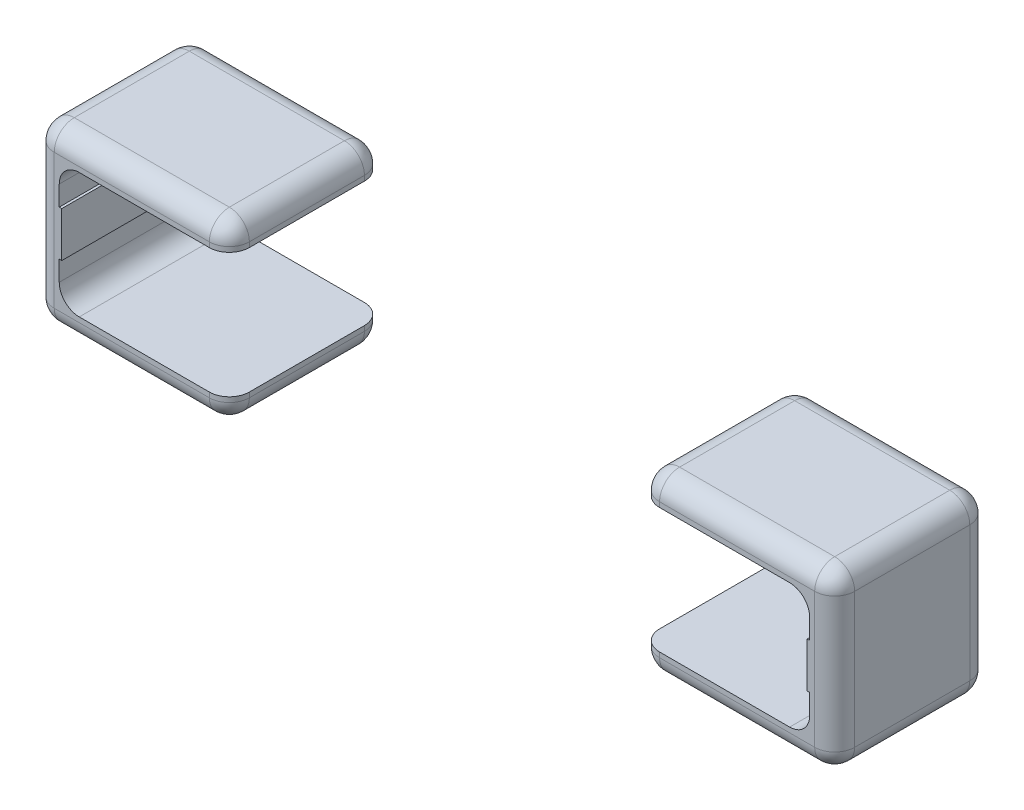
SolidWorks part; units mm, degrees
ref_plane "Front Plane" through (0, 0, 0) normal (0, 0, 1) x (1, 0, 0)
ref_plane "Top Plane" through (0, 0, 0) normal (0, 1, 0) x (1, 0, 0)
ref_plane "Right Plane" through (0, 0, 0) normal (1, 0, 0) x (0, 0, -1)
sketch "Skizze1" plane through (0, 0, 0) normal (0, 0, 1) x (1, 0, 0)
  line L2 (-40, 12.5) -> (-40, -5)
  line L3 (-40, -5) -> (40, -5)
  line L5 (-40, -3) -> (-40, 10.5) construction
  line L6 (-22, -5) -> (-38, -5) construction
  line L7 (-40, 12.5) -> (40, 12.5)
  line L9 (40, -5) -> (40, 12.5)
  line L10 (22, 12.5) -> (38, 12.5) construction
  line L11 (40, 10.5) -> (40, -3) construction
extrude "Linear austragen1" add sketch "Skizze1" against normal blind 15 and the other way blind 1.5
sketch "Skizze2" plane through (0, 0, 1.5) normal (0, 0, 1) x (1, 0, 0)
  line L0 (40, -5) -> (40, 12.5) construction
  line L1 (-50, 22.5) -> (50, 22.5)
  line L2 (-50, 22.5) -> (-50, -15)
  line L3 (-50, -15) -> (50, -15)
  line L4 (50, 22.5) -> (50, -15)
  line L5 (-40, 12.5) -> (-40, -5) construction
  line L6 (-40, -5) -> (40, -5) construction
  line L7 (40, 12.5) -> (-40, 12.5) construction
  dimension "D1" = 10
  dimension "D2" = 10
  dimension "D3" = 10
  dimension "D4" = 10
extrude "Schnitt-Linear austragen1" cut sketch "Skizze2" against normal blind 1
sketch "Skizze4" plane through (0, 0, 0.5) normal (0, 0, 1) x (1, 0, 0)
  line L0 (-37.5, 6) -> (-37.5, 8) construction
  line L5 (-37.5, 6) -> (-37.5, 8)
  line L6 (-37.25, 1.5) -> (-37.25, 6) construction
  line L7 (-37.25, 1.5) -> (-37.25, 6)
  line L8 (-37.5, -0.5) -> (-37.5, 1.5) construction
  line L9 (-37.5, -0.5) -> (-37.5, 1.5)
  line L10 (-35.5, 10) -> (35.5, 10) construction
  line L11 (-35.5, 10) -> (35.5, 10)
  line L12 (35.5, -2.5) -> (-35.5, -2.5) construction
  line L13 (35.5, -2.5) -> (-35.5, -2.5)
  line L14 (-37.25, 1.5) -> (-37.5, 1.5) construction
  line L15 (-37.25, 1.5) -> (-37.5, 1.5)
  line L16 (-37.5, 6) -> (-37.25, 6) construction
  line L17 (-37.5, 6) -> (-37.25, 6)
  line L18 (37.5, 1.5) -> (37.5, -0.5) construction
  line L19 (37.5, 1.5) -> (37.5, -0.5)
  line L20 (37.5, 1.5) -> (37.25, 1.5) construction
  line L21 (37.5, 1.5) -> (37.25, 1.5)
  line L22 (37.25, 6) -> (37.25, 1.5) construction
  line L23 (37.25, 6) -> (37.25, 1.5)
  line L24 (37.25, 6) -> (37.5, 6) construction
  line L25 (37.25, 6) -> (37.5, 6)
  line L26 (37.5, 8) -> (37.5, 6) construction
  line L27 (37.5, 8) -> (37.5, 6)
  arc A0 (-35.5, 10) -> (-37.5, 8) centre (-35.5, 8) ccw construction
  arc A1 (-35.5, 10) -> (-37.5, 8) centre (-35.5, 8) ccw
  arc A2 (-37.5, -0.5) -> (-35.5, -2.5) centre (-35.5, -0.5) ccw construction
  arc A3 (-37.5, -0.5) -> (-35.5, -2.5) centre (-35.5, -0.5) ccw
  arc A4 (35.5, -2.5) -> (37.5, -0.5) centre (35.5, -0.5) ccw construction
  arc A5 (35.5, -2.5) -> (37.5, -0.5) centre (35.5, -0.5) ccw
  arc A6 (37.5, 8) -> (35.5, 10) centre (35.5, 8) ccw construction
  arc A7 (37.5, 8) -> (35.5, 10) centre (35.5, 8) ccw
extrude "Schnitt-Linear austragen2" cut sketch "Skizze4" against normal up to surface (15.5 mm away)
fillet "Verrundung1" radius 2 12 edges at (40, 3.75, 0.5) (-40, 3.75, 0.5) (0, -5, 0.5) (0, 12.5, 0.5) (0, -5, -15) (0, 12.5, -15) (40, 3.75, -15) (-40, 3.75, -15) (40, -5, -7.25) (40, 12.5, -7.25) (-40, -5, -7.25) (-40, 12.5, -7.25)
sketch "Skizze5" plane through (0, 0, -15) normal (0, 0, -1) x (-1, 0, 0)
  line L0 (36.5, -0.5) -> (36.5, 8) construction
  line L1 (-20.5, 24.85) -> (20.5, 24.85)
  line L2 (-20.5, 24.85) -> (-20.5, -12.6074)
  line L3 (-20.5, -12.6074) -> (20.5, -12.6074)
  line L4 (20.5, 24.85) -> (20.5, -12.6074)
  line L5 (-36.5, 8) -> (-36.5, -0.5) construction
  dimension "D1" = 16
  dimension "D2" = 16
extrude "Schnitt-Linear austragen3" cut sketch "Skizze5" against normal through all
fillet "Verrundung2" radius 2 10 edges at (20.5, -2.75, 0.5) (20.5, -4.4142, -0.0858) (20.5, -2.75, -15) (20.5, -4.4142, -14.4142) (20.5, 10.25, -15) (20.5, 11.9142, -14.4142) (20.5, 10.25, 0.5) (20.5, 11.9142, -0.0858) (20.5, -5, -7.25) (20.5, 12.5, -7.25)
fillet "Verrundung3" radius 2 10 edges at (-20.5, 10.25, 0.5) (-20.5, 11.9142, -0.0858) (-20.5, 10.25, -15) (-20.5, 11.9142, -14.4142) (-20.5, -2.75, -15) (-20.5, -4.4142, -14.4142) (-20.5, -2.75, 0.5) (-20.5, -4.4142, -0.0858) (-20.5, 12.5, -7.25) (-20.5, -5, -7.25)
